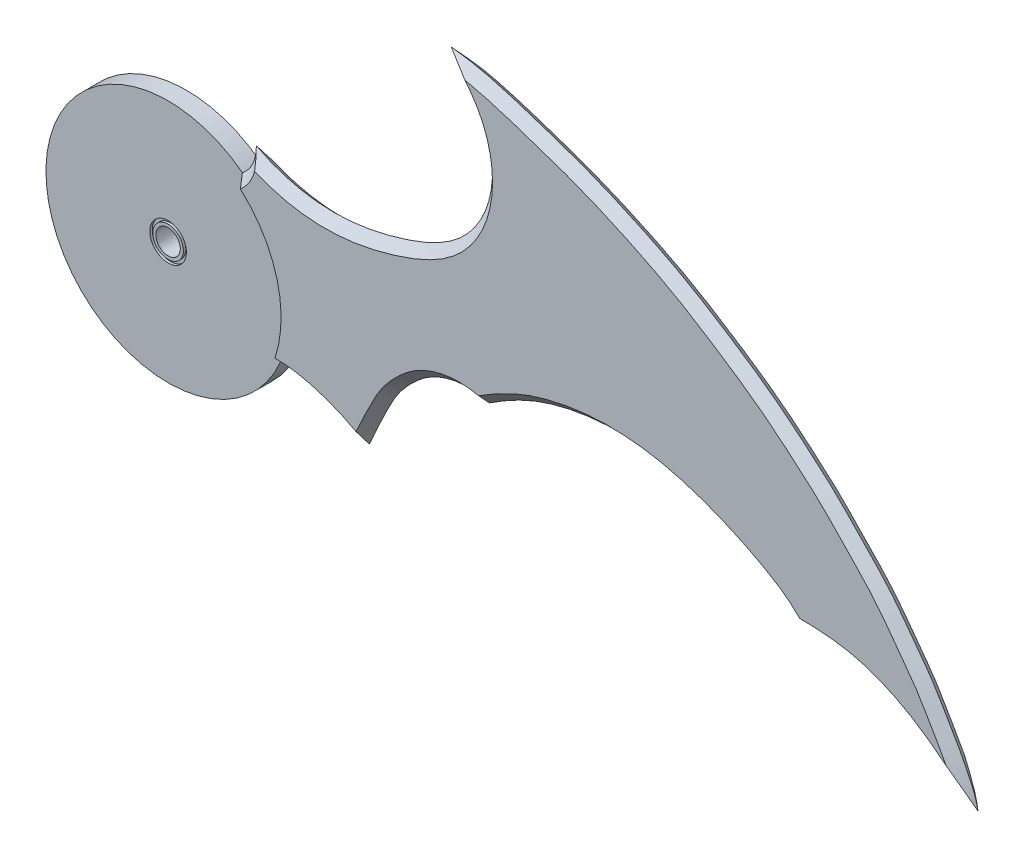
SolidWorks part; units mm, degrees
ref_plane "Front Plane" through (0, 0, 0) normal (0, 0, 1) x (1, 0, 0)
ref_plane "Top Plane" through (0, 0, 0) normal (0, 1, 0) x (1, 0, 0)
ref_plane "Right Plane" through (0, 0, 0) normal (1, 0, 0) x (0, 0, -1)
sketch "Sketch1" plane through (0, 0, 0) normal (0, 0, 1) x (1, 0, 0)
  line L0 (42.5193, 306.0455) -> (909.1859, 306.0455) construction
  arc A0 (15.4455, 20.1642) -> (23.3982, -9.8835) centre (0, 0) ccw
  spline S0 degree 2 poles (15.4455, 20.1642) (18.3695, 22.534) (18.3455, 26.5077) knots 0 0 0 1 1 1
  spline S1 degree 3 poles (18.3455, 26.5077) (22.8474, 24.0335) (33.3064, 21.4212) (48.4146, 24.2054) (60.5953, 29.5037) (66.4433, 38.2623) (68.1696, 47.3731) (65.6593, 57.1395) (60.8572, 62.1511) (58.8625, 64.5352) knots 0 0 0 0 0.187275 0.379823 0.554785 0.65168 0.751197 0.886058 1 1 1 1
  spline S2 degree 3 poles (58.8625, 64.5352) (65.6096, 63.8469) (74.5551, 60.8439) (87.1051, 56.6529) (97.1984, 52.3403) (106.9681, 47.4872) (114.9272, 42.5159) (120.3939, 38.9498) (125.5131, 35.3548) (130.5122, 31.4256) (135.2508, 27.2929) (139.2629, 23.7153) (143.1067, 19.6256) (146.7568, 15.9685) (150.0666, 12.3213) (152.5018, 9.2627) (155.5951, 4.8919) (158.9998, 0.5378) (161.8243, -4.4839) (164.2911, -8.5362) (166.7235, -13.2608) (168.071, -16.4403) (168.4005, -18.328) knots 0 0 0 0 0.141121 0.197381 0.277535 0.371123 0.425842 0.474265 0.50803 0.557019 0.60754 0.639927 0.669692 0.725199 0.748311 0.772957 0.80714 0.860665 0.88856 0.927866 0.960151 1 1 1 1
  spline S3 degree 3 poles (23.3982, -9.8835) (25.5293, -9.7608) (29.4354, -10.2117) (35.6827, -12.1498) (39.666, -14.0596) (41.854, -15.51) knots 0 0 0 0 0.326278 0.598126 1 1 1 1
  spline S4 degree 3 poles (41.854, -15.51) (42.9405, -12.9261) (44.9413, -8.7427) (47.6019, -3.4056) (50.5667, -0.1524) (53.364, 2.3584) (58.6359, 5.121) (63.4836, 5.3633) (66.8001, 4.3978) knots 0 0 0 0 0.237081 0.394988 0.50116 0.608127 0.71221 1 1 1 1
  spline S5 degree 3 poles (66.8001, 4.3978) (69.6723, 6.2532) (74.6858, 9.1557) (83.169, 11.7402) (92.2683, 12.9859) (102.9519, 12.2227) (113.8626, 8.9415) (123.8848, 4.3549) (130.1047, 0.4679) (132.375, -2.1538) knots 0 0 0 0 0.145316 0.243412 0.374115 0.532598 0.69325 0.854076 1 1 1 1
  spline S6 degree 3 poles (132.375, -2.1538) (135.9971, -2.1525) (143.7407, -2.4433) (156.5407, -7.7073) (164.1453, -14.255) (168.4005, -18.328) knots 0 0 0 0 0.267953 0.564652 1 1 1 1
extrude "Boss-Extrude2" add sketch "Sketch1" along normal blind 3.81
sketch "Sketch3" plane through (0, 0, 3.81) normal (0, 0, 1) x (1, 0, 0)
  circle A0 centre (0, 0) radius 2.54
extrude "Cut-Extrude2" cut sketch "Sketch3" against normal blind 3.81
sketch "Sketch4" plane through (0, 0, 3.81) normal (0, 0, 1) x (1, 0, 0)
  arc A0 (23.3982, -9.8835) -> (15.4455, 20.1642) centre (0, 0) ccw
  arc A1 (15.4455, 20.1642) -> (23.3982, -9.8835) centre (0, 0) ccw
  parabola Q1
  parabola Q2
  spline S6 degree 3 poles (835.106, -3920.9267) (-126.0801, -149.7755) (-25.5321, 6.841) (106.1801, -34.0204) (109.8088, -247.4997) (-2602.6926, -3005.9177) knots -8.798684 -8.798684 -8.798684 -8.798684 0.326278 0.598126 12.284563 12.284563 12.284563 12.284563 only from (23.3982, -9.8835) to (41.854, -15.51)
  spline S7 degree 3 poles (2730.9028, -2971.2749) (1.7146, -162.1767) (5.4956, -87.8691) (47.6019, -3.4056) (50.5667, -0.1524) (53.364, 2.3584) (112.8097, 33.5092) (311.1653, -318.188) (-3517.4107, -1721.0923) knots -7.430035 -7.430035 -7.430035 -7.430035 0.237081 0.394988 0.50116 0.608127 0.71221 6.126081 6.126081 6.126081 6.126081 only from (41.854, -15.51) to (66.8001, 4.3978)
  spline S8 degree 3 poles (-742.4749, 3918.8679) (29.5785, -324.7543) (-4.0155, -14.8207) (83.169, 11.7402) (92.2683, 12.9859) (102.9519, 12.2227) (113.8626, 8.9415) (172.9457, -18.0974) (203.003, -106.3083) (-2611.0116, -2908.8002) knots -3.470759 -3.470759 -3.470759 -3.470759 0.145316 0.243412 0.374115 0.532598 0.69325 0.854076 3.288053 3.288053 3.288053 3.288053 only from (66.8001, 4.3978) to (132.375, -2.1538)
  spline S9 degree 3 poles (1416.1015, 3783.3861) (-62.6418, -248.5328) (73.6734, 26.3721) (252.3765, -47.12) (135.0096, -430.0124) (1967.4091, 3548.1961) knots -5.473992 -5.473992 -5.473992 -5.473992 0.267953 0.564652 8.487158 8.487158 8.487158 8.487158 only from (132.375, -2.1538) to (168.4005, -18.328)
  spline S10 degree 3 poles (-3648.5308, -1208.8495) (168.5492, -107.3992) (185.1369, -49.0253) (164.2911, -8.5362) (161.8243, -4.4839) (158.9998, 0.5378) (155.5951, 4.8919) (152.5018, 9.2627) (150.0666, 12.3213) (146.7568, 15.9685) (143.1067, 19.6256) (139.2629, 23.7153) (135.2508, 27.2929) (130.5122, 31.4256) (125.5131, 35.3548) (120.3939, 38.9498) (114.9272, 42.5159) (106.9681, 47.4872) (97.1984, 52.3403) (87.1051, 56.6529) (-7.4934, 88.2435) (-100.5508, 120.9578) (-1100.4402, -3757.598) knots -0.843593 -0.843593 -0.843593 -0.843593 0.039849 0.072134 0.11144 0.139335 0.19286 0.227043 0.251689 0.274801 0.330308 0.360073 0.39246 0.442981 0.49197 0.525735 0.574158 0.628877 0.722465 0.802619 0.858879 2.814453 2.814453 2.814453 2.814453 only from (168.4005, -18.328) to (58.8625, 64.5352)
  spline S11 degree 3 poles (3422.4968, 2225.4602) (-166.5164, 31.7074) (52.6736, 107.6612) (68.1696, 47.3731) (66.4433, 38.2623) (60.5953, 29.5037) (48.4146, 24.2054) (-53.0614, 5.5052) (-159.8696, 382.6886) (3670.6035, 1598.9509) knots -1.801856 -1.801856 -1.801856 -1.801856 0.113942 0.248803 0.34832 0.445215 0.620177 0.812725 4.171504 4.171504 4.171504 4.171504 only from (58.8625, 64.5352) to (18.3455, 26.5077)
  spline S12 degree 3 poles (23.3982, -9.8835) (25.5293, -9.7608) (29.4354, -10.2117) (35.6827, -12.1498) (39.666, -14.0596) (41.854, -15.51) knots 0 0 0 0 0.326278 0.598126 1 1 1 1
  spline S13 degree 3 poles (41.854, -15.51) (42.9405, -12.9261) (44.9413, -8.7427) (47.6019, -3.4056) (50.5667, -0.1524) (53.364, 2.3584) (58.6359, 5.121) (63.4836, 5.3633) (66.8001, 4.3978) knots 0 0 0 0 0.237081 0.394988 0.50116 0.608127 0.71221 1 1 1 1
  spline S14 degree 3 poles (66.8001, 4.3978) (69.6723, 6.2532) (74.6858, 9.1557) (83.169, 11.7402) (92.2683, 12.9859) (102.9519, 12.2227) (113.8626, 8.9415) (123.8848, 4.3549) (130.1047, 0.4679) (132.375, -2.1538) knots 0 0 0 0 0.145316 0.243412 0.374115 0.532598 0.69325 0.854076 1 1 1 1
  spline S15 degree 3 poles (132.375, -2.1538) (135.9971, -2.1525) (143.7407, -2.4433) (156.5407, -7.7073) (164.1453, -14.255) (168.4005, -18.328) knots 0 0 0 0 0.267953 0.564652 1 1 1 1
  spline S16 degree 3 poles (168.4005, -18.328) (168.071, -16.4403) (166.7235, -13.2608) (164.2911, -8.5362) (161.8243, -4.4839) (158.9998, 0.5378) (155.5951, 4.8919) (152.5018, 9.2627) (150.0666, 12.3213) (146.7568, 15.9685) (143.1067, 19.6256) (139.2629, 23.7153) (135.2508, 27.2929) (130.5122, 31.4256) (125.5131, 35.3548) (120.3939, 38.9498) (114.9272, 42.5159) (106.9681, 47.4872) (97.1984, 52.3403) (87.1051, 56.6529) (74.5551, 60.8439) (65.6096, 63.8469) (58.8625, 64.5352) knots 0 0 0 0 0.039849 0.072134 0.11144 0.139335 0.19286 0.227043 0.251689 0.274801 0.330308 0.360073 0.39246 0.442981 0.49197 0.525735 0.574158 0.628877 0.722465 0.802619 0.858879 1 1 1 1
  spline S17 degree 3 poles (58.8625, 64.5352) (60.8572, 62.1511) (65.6593, 57.1395) (68.1696, 47.3731) (66.4433, 38.2623) (60.5953, 29.5037) (48.4146, 24.2054) (33.3064, 21.4212) (22.8474, 24.0335) (18.3455, 26.5077) knots 0 0 0 0 0.113942 0.248803 0.34832 0.445215 0.620177 0.812725 1 1 1 1
  dimension "D1" = 0
extrude "Boss-Extrude3" add sketch "Sketch4" along normal blind 1.905
sketch "Sketch5" plane through (0, 0, 0) normal (0, 0, -1) x (-1, 0, 0)
  arc A0 (-15.4455, 20.1642) -> (-23.3982, -9.8835) centre (0, 0) ccw
  arc A1 (-23.3982, -9.8835) -> (-15.4455, 20.1642) centre (0, 0) ccw
  parabola Q1
  parabola Q2
  spline S6 degree 3 poles (-3670.5813, 1598.9439) (159.8692, 382.6872) (53.0612, 5.5052) (-48.4146, 24.2054) (-60.5953, 29.5037) (-66.4433, 38.2623) (-68.1696, 47.3731) (-52.6736, 107.6612) (166.5167, 31.7073) (-3422.504, 2225.4646) knots -3.171498 -3.171498 -3.171498 -3.171498 0.187275 0.379823 0.554785 0.65168 0.751197 0.886058 2.801857 2.801857 2.801857 2.801857 only from (-18.3455, 26.5077) to (-58.8625, 64.5352)
  spline S7 degree 3 poles (1100.4137, -3757.495) (100.5492, 120.9573) (7.4926, 88.2432) (-87.1051, 56.6529) (-97.1984, 52.3403) (-106.9681, 47.4872) (-114.9272, 42.5159) (-120.3939, 38.9498) (-125.5131, 35.3548) (-130.5122, 31.4256) (-135.2508, 27.2929) (-139.2629, 23.7153) (-143.1067, 19.6256) (-146.7568, 15.9685) (-150.0666, 12.3213) (-152.5018, 9.2627) (-155.5951, 4.8919) (-158.9998, 0.5378) (-161.8243, -4.4839) (-164.2911, -8.5362) (-185.1365, -49.0245) (-168.5499, -107.3969) (3648.3, -1208.7829) knots -1.814436 -1.814436 -1.814436 -1.814436 0.141121 0.197381 0.277535 0.371123 0.425842 0.474265 0.50803 0.557019 0.60754 0.639927 0.669692 0.725199 0.748311 0.772957 0.80714 0.860665 0.88856 0.927866 0.960151 1.843575 1.843575 1.843575 1.843575 only from (-58.8625, 64.5352) to (-168.4005, -18.328)
  spline S8 degree 3 poles (-1967.3912, 3548.1574) (-135.0103, -430.01) (-252.3762, -47.1199) (-73.6746, 26.3716) (62.6376, -248.5243) (-1416.0292, 3783.189) knots -7.487132 -7.487132 -7.487132 -7.487132 0.435348 0.732047 6.473899 6.473899 6.473899 6.473899 only from (-168.4005, -18.328) to (-132.375, -2.1538)
  spline S9 degree 3 poles (2611.0558, -2908.8443) (-203.0033, -106.3092) (-172.946, -18.0975) (-113.8626, 8.9415) (-102.9519, 12.2227) (-92.2683, 12.9859) (-83.169, 11.7402) (4.0151, -14.8206) (-29.5782, -324.7514) (742.4639, 3918.8074) knots -2.288066 -2.288066 -2.288066 -2.288066 0.145924 0.30675 0.467402 0.625885 0.756588 0.854684 4.470742 4.470742 4.470742 4.470742 only from (-132.375, -2.1538) to (-66.8001, 4.3978)
  spline S10 degree 3 poles (3517.4466, -1721.1054) (-311.1665, -318.1902) (-112.8099, 33.5093) (-53.364, 2.3584) (-50.5667, -0.1524) (-47.6019, -3.4056) (-5.4957, -87.8687) (-1.7147, -162.176) (-2730.8653, -2971.2363) knots -5.126098 -5.126098 -5.126098 -5.126098 0.28779 0.391873 0.49884 0.605012 0.762919 8.43 8.43 8.43 8.43 only from (-66.8001, 4.3978) to (-41.854, -15.51)
  spline S11 degree 3 poles (2602.6992, -3005.9244) (-109.8089, -247.5001) (-106.1802, -34.0204) (25.532, 6.841) (126.0798, -149.775) (-835.1017, -3920.9099) knots -11.284573 -11.284573 -11.284573 -11.284573 0.401874 0.673722 9.79867 9.79867 9.79867 9.79867 only from (-41.854, -15.51) to (-23.3982, -9.8835)
  spline S12 degree 3 poles (-18.3455, 26.5077) (-22.8474, 24.0335) (-33.3064, 21.4212) (-48.4146, 24.2054) (-60.5953, 29.5037) (-66.4433, 38.2623) (-68.1696, 47.3731) (-65.6593, 57.1395) (-60.8572, 62.1511) (-58.8625, 64.5352) knots 0 0 0 0 0.187275 0.379823 0.554785 0.65168 0.751197 0.886058 1 1 1 1
  spline S13 degree 3 poles (-58.8625, 64.5352) (-65.6096, 63.8469) (-74.5551, 60.8439) (-87.1051, 56.6529) (-97.1984, 52.3403) (-106.9681, 47.4872) (-114.9272, 42.5159) (-120.3939, 38.9498) (-125.5131, 35.3548) (-130.5122, 31.4256) (-135.2508, 27.2929) (-139.2629, 23.7153) (-143.1067, 19.6256) (-146.7568, 15.9685) (-150.0666, 12.3213) (-152.5018, 9.2627) (-155.5951, 4.8919) (-158.9998, 0.5378) (-161.8243, -4.4839) (-164.2911, -8.5362) (-166.7235, -13.2608) (-168.071, -16.4403) (-168.4005, -18.328) knots 0 0 0 0 0.141121 0.197381 0.277535 0.371123 0.425842 0.474265 0.50803 0.557019 0.60754 0.639927 0.669692 0.725199 0.748311 0.772957 0.80714 0.860665 0.88856 0.927866 0.960151 1 1 1 1
  spline S14 degree 3 poles (-168.4005, -18.328) (-164.1453, -14.255) (-156.5407, -7.7073) (-143.7407, -2.4433) (-135.9971, -2.1525) (-132.375, -2.1538) knots 0 0 0 0 0.435348 0.732047 1 1 1 1
  spline S15 degree 3 poles (-132.375, -2.1538) (-130.1047, 0.4679) (-123.8848, 4.3549) (-113.8626, 8.9415) (-102.9519, 12.2227) (-92.2683, 12.9859) (-83.169, 11.7402) (-74.6858, 9.1557) (-69.6723, 6.2532) (-66.8001, 4.3978) knots 0 0 0 0 0.145924 0.30675 0.467402 0.625885 0.756588 0.854684 1 1 1 1
  spline S16 degree 3 poles (-66.8001, 4.3978) (-63.4836, 5.3633) (-58.6359, 5.121) (-53.364, 2.3584) (-50.5667, -0.1524) (-47.6019, -3.4056) (-44.9413, -8.7427) (-42.9405, -12.9261) (-41.854, -15.51) knots 0 0 0 0 0.28779 0.391873 0.49884 0.605012 0.762919 1 1 1 1
  spline S17 degree 3 poles (-41.854, -15.51) (-39.666, -14.0596) (-35.6827, -12.1498) (-29.4354, -10.2117) (-25.5293, -9.7608) (-23.3982, -9.8835) knots 0 0 0 0 0.401874 0.673722 1 1 1 1
  dimension "D1" = 0
extrude "Cut-Extrude3" cut sketch "Sketch5" against normal blind 1.905
chamfer "Chamfer1" distance 1.905 angle 45 28 edges at (15.4455, 20.1642, 2.8575) (18.3455, 26.5077, 4.7625) (15.4455, 20.1642, 4.7625) (23.3982, -9.8835, 4.7625) (63.969, 34.7948, 5.715) (24.5545, 6.4988, 5.715) (28.3547, -10.1934, 5.715) (50.9893, 0.1722, 5.715) (96.6521, 12.5642, 5.715) (147.1074, -4.0862, 5.715) (138.1157, 24.7123, 5.715) (37.525, -13.1168, 1.905) (56.3784, 3.8222, 1.905) (99.7921, 12.2819, 1.905) (152.7602, -6.4878, 1.905) (136.69, 26.0043, 1.905) (61.8046, 32.1118, 1.905)
sketch "Sketch6" plane through (0, 0, 3.81) normal (0, 0, 1) x (1, 0, 0)
  line L0 (0, 0) -> (8.9803, 8.9803) construction
  line L1 (0, 4.1734) -> (0, -9.2534)
  circle A0 centre (8.9803, 8.9803) radius 1.27
  circle A2 centre (-8.9803, 8.9803) radius 1.27
  point P7 (0, -2.54)
  dimension "D1" = 12.7
sketch "Sketch8" plane through (0, 0, 3.81) normal (0, 0, 1) x (1, 0, 0)
  circle A0 centre (0, 0) radius 3.175
  circle A1 centre (0, 0) radius 3.81
extrude "Cut-Extrude5" cut sketch "Sketch8" against normal blind 0.508
